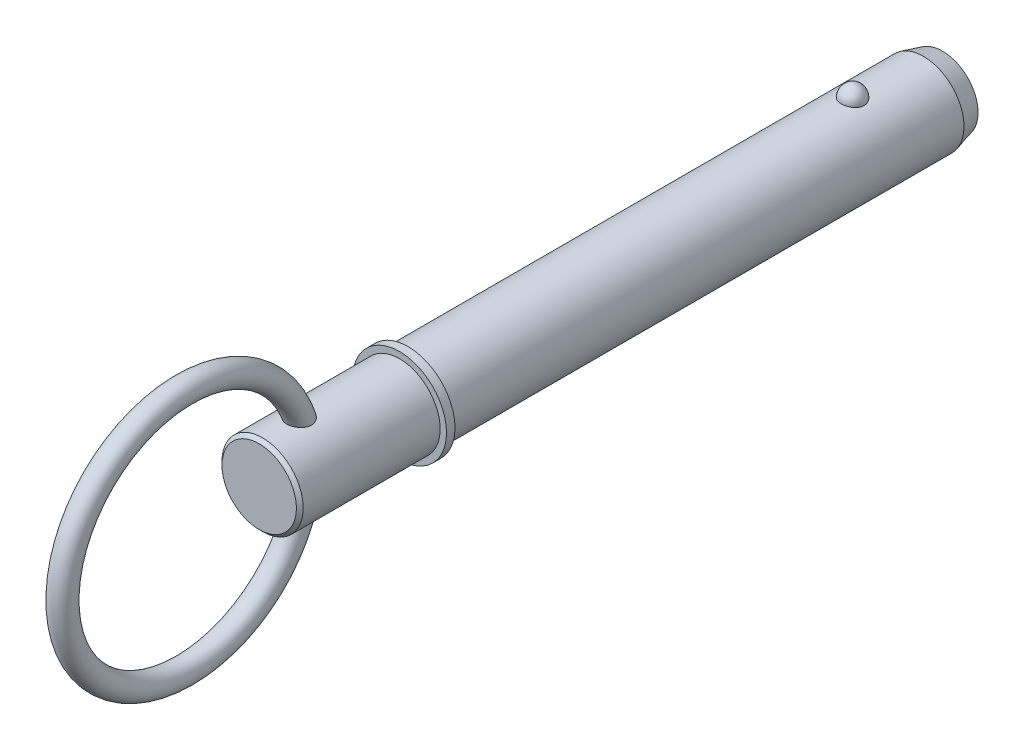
SolidWorks part; units mm, degrees
ref_plane "Front Plane" through (0, 0, 0) normal (0, 0, 1) x (1, 0, 0)
ref_plane "Top Plane" through (0, 0, 0) normal (0, 1, 0) x (1, 0, 0)
ref_plane "Right Plane" through (0, 0, 0) normal (1, 0, 0) x (0, 0, -1)
sketch "Sketch2" plane through (0, 0, 0) normal (0, 0, 1) x (1, 0, 0)
  circle A0 centre (0, 0) radius 9.525
  point P3 (0, 9.525)
  dimension "D1" = 19.05
extrude "Boss-Extrude1" add sketch "Sketch2" along normal blind 101.6
sketch "Sketch3" plane through (0, 0, 0) normal (0, 0, -1) x (-1, 0, 0)
  circle A0 centre (0, 0) radius 9.525
  dimension "D1" = 19.05
extrude "Boss-Extrude2" add sketch "Sketch3" along normal blind 23.8
chamfer "Chamfer1" distance 4.5 angle 15 1 edges at (-9.525, 0, -23.8)
sketch "Sketch18" plane through (0, 0, 0) normal (1, 0, 0) x (0, 0, -1)
  line L0 (19.3, 9.525) -> (-101.6, 9.525) construction
  line L1 (2.69, 12.215) -> (2.69, 6.835)
  line L2 (-101.6, -9.525) -> (19.3, -9.525) construction
  arc A0 (2.69, 12.215) -> (2.69, 6.835) centre (2.69, 9.525) ccw
  point P4 (0, 9.525)
  dimension "D1" = 21.74
revolve "Revolve1" add sketch "Sketch18" angle 360 about L1
sketch "Sketch19" plane through (0, 0, 0) normal (1, 0, 0) x (0, 0, -1)
  line L0 (-33.7288, 0) -> (-46.4542, 0) construction
sketch "Sketch20" plane through (0, 0, 0) normal (1, 0, 0) x (0, 0, -1)
  line L0 (-101.6, 0) -> (-101.6, 11)
  line L1 (-101.6, 9.525) -> (-101.6, -9.525) construction
  line L2 (-101.6, 11) -> (-103.6, 11)
  line L3 (-103.6, 11) -> (-103.6, 0)
  line L4 (-33.7288, 0) -> (-46.4542, 0) construction
  line L5 (-103.6, 0) -> (-101.6, 0)
  dimension "D1" = 11
  dimension "D2" = 2
revolve "Revolve2" add sketch "Sketch20" angle 360 about L0
sketch "Sketch21" plane through (0, 0, 101.6) normal (0, 0, -1) x (-1, 0, 0)
  circle A0 centre (0, 0) radius 9.525
  dimension "D1" = 19.05
extrude "Boss-Extrude3" add sketch "Sketch21" against normal blind 34.93
chamfer "Chamfer2" distance 0.8 angle 45 1 edges at (-9.525, 0, 136.53)
sketch "Sketch23" plane through (0, 0, 0) normal (1, 0, 0) x (0, 0, -1)
  line L0 (-136.53, 8.725) -> (-136.53, -8.725) construction
  circle A0 centre (-154.105, 0) radius 28.575
  point P2 (-125.53, 0)
  dimension "D1" = 57.15
  dimension "D2" = 11
sketch "Sketch24" plane through (0, 0, 0) normal (0, 1, 0) x (1, 0, 0)
  circle A0 centre (0, -125.53) radius 2.75
  dimension "D1" = 5.5
sweep "Sweep1" add profiles "Sketch24" path "Sketch23"
